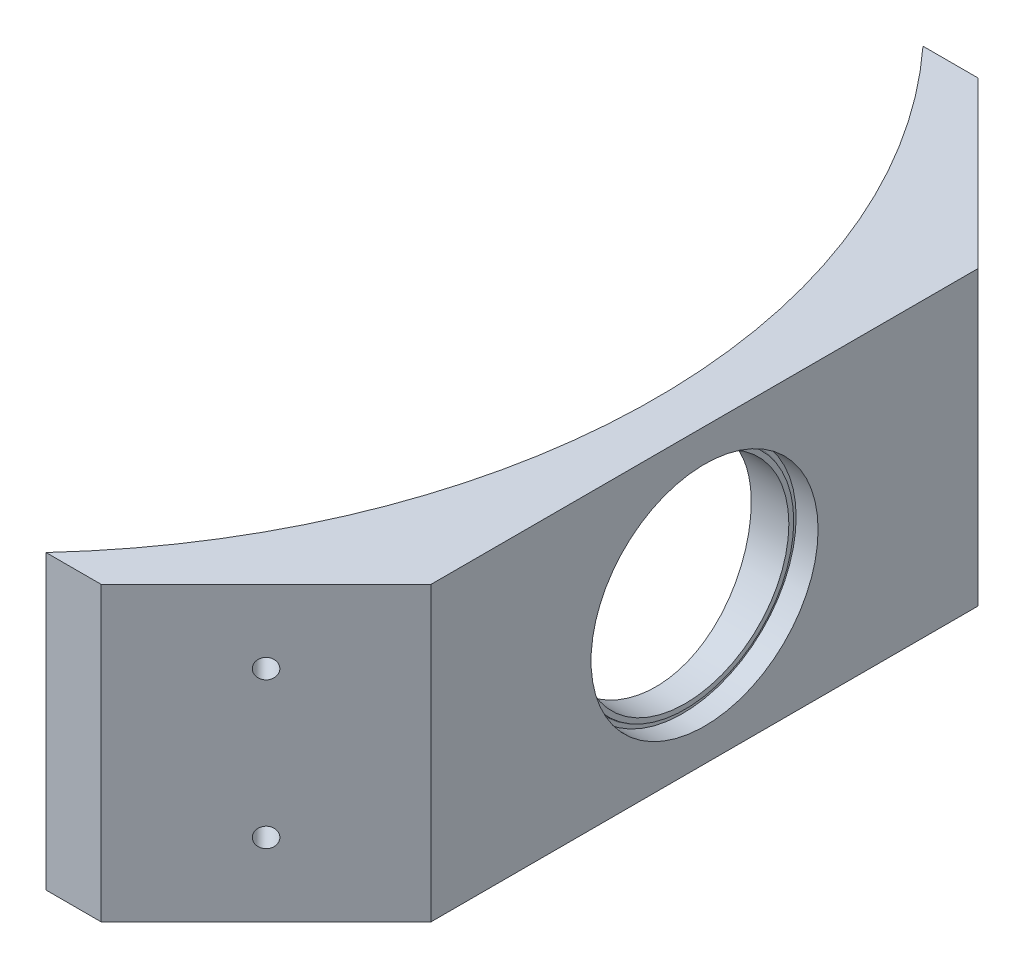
SolidWorks part; units mm, degrees
ref_plane "Front Plane" through (0, 0, 0) normal (0, 0, 1) x (1, 0, 0)
ref_plane "Top Plane" through (0, 0, 0) normal (0, 1, 0) x (1, 0, 0)
ref_plane "Right Plane" through (0, 0, 0) normal (1, 0, 0) x (0, 0, -1)
sketch "Sketch1" plane through (0, 0, 0) normal (1, 0, 0) x (0, 0, -1)
  line L0 (44.8181, 64.7501) -> (49.8181, 64.7501)
  line L1 (-35.1819, 64.7501) -> (-40.1819, 64.7501)
  line L2 (-40.1819, 64.7501) -> (-40.1819, 34.7501)
  line L3 (-35.1819, 64.7501) -> (44.8181, 64.7501)
  line L4 (-40.1819, 34.7501) -> (-35.1819, 34.7501)
  line L5 (4.8181, 49.7501) -> (4.8181, 64.7501) construction
  line L6 (49.8181, 64.7501) -> (49.8181, 34.7501)
  line L7 (44.8181, 34.7501) -> (-35.1819, 34.7501)
  line L8 (49.8181, 34.7501) -> (44.8181, 34.7501)
  circle A0 centre (4.8181, 49.7501) radius 10.65
  point P2 (4.8181, 34.7501)
  dimension "D1" = 5
  dimension "D2" = 5
extrude "Boss-Extrude1" add sketch "Sketch1" along normal blind 4
sketch "Sketch4" plane through (4, 0, 0) normal (1, 0, 0) x (0, 0, -1)
  circle A0 centre (4.8181, 49.7501) radius 10.65
  circle A3 centre (4.8181, 49.7501) radius 11.65
extrude "Cut-Extrude2" cut sketch "Sketch4" against normal blind 2
sketch "Sketch5" plane through (2, 0, 0) normal (1, 0, 0) x (0, 0, -1)
  circle A0 centre (4.8181, 49.7501) radius 11.65
  circle A1 centre (4.8181, 49.7501) radius 11.15
  dimension "D1" = 0.5
extrude "Cut-Extrude3" cut sketch "Sketch5" against normal blind 0.25
fillet "Fillet1" radius 0.1 1 edges at (1.75, 49.7501, -15.9681)
sketch "Sketch11" plane through (0, 64.7501, 0) normal (0, 1, 0) x (1, 0, 0)
  line L0 (0, 4.8181) -> (-1, 4.8181) construction
  line L2 (-1, 4.8181) -> (-67.37, 4.8181) construction
  line L3 (0, 49.8181) -> (0, -40.1819)
  line L4 (0, 49.8181) -> (0, -40.1819) construction
  line L5 (0, 49.8181) -> (-18.585, 49.8181)
  line L6 (0, -40.1819) -> (-18.585, -40.1819)
  arc A1 (-18.585, -40.1819) -> (-18.585, 49.8181) centre (-67.37, 4.8181) ccw
  dimension "D1" = 1
extrude "Boss-Extrude3" add sketch "Sketch11" against normal blind 30
sketch "Sketch12" plane through (0, 0, 0) normal (1, 0, 0) x (0, 0, -1)
  circle A0 centre (4.8181, 49.7501) radius 10.65
extrude "Cut-Extrude6" cut sketch "Sketch12" against normal blind 30
sketch "Sketch13" plane through (0, 64.7501, 0) normal (0, 1, 0) x (1, 0, 0)
  line L0 (-18.585, 49.8181) -> (-7.2925, 49.8181) construction
  line L2 (4, 49.8181) -> (4, -40.1819) construction
  line L3 (4, 4.8181) -> (-14.9281, 4.8181) construction
  line L4 (4, 49.8181) -> (-18.585, 49.8181) construction
  line L5 (-12.9387, 49.8181) -> (4, 32.8793)
  line L6 (4, 32.8793) -> (4, 49.8181)
  line L7 (4, 49.8181) -> (-12.9387, 49.8181)
  line L8 (-12.9387, -40.1819) -> (4, -23.2432)
  line L9 (4, -23.2432) -> (4, -40.1819)
  line L10 (4, -40.1819) -> (-12.9387, -40.1819)
extrude "Cut-Extrude7" cut sketch "Sketch13" against normal blind 30
sketch "Sketch14" plane through (-109.6206, 0, 136.8638) normal (-0.7071, 0, -0.7071) x (-0.7071, 0, 0.7071)
  line L0 (-148.7063, 64.7501) -> (-148.7063, 49.7501) construction
  line L1 (-160.6838, 64.7501) -> (-136.7288, 64.7501) construction
  line L3 (-136.7288, 49.7501) -> (-160.6838, 49.7501) construction
  line L4 (-136.7288, 34.7501) -> (-136.7288, 64.7501) construction
  line L5 (-160.6838, 34.7501) -> (-160.6838, 64.7501) construction
  circle A0 centre (-148.7063, 57.2501) radius 1
  circle A1 centre (-148.7063, 42.2501) radius 1
  dimension "D1" = 2
extrude "Cut-Extrude8" cut sketch "Sketch14" along normal blind 30
sketch "Sketch15" plane through (18.5398, 0, -18.3395) normal (-0.7071, 0, 0.7071) x (0.7071, 0, 0.7071)
  line L0 (-32.3983, 49.7501) -> (-32.3983, 64.7501) construction
  line L1 (-20.156, 49.7501) -> (-44.7869, 49.7501) construction
  line L2 (-20.5624, 64.7501) -> (-44.5174, 64.7501) construction
  circle A0 centre (-32.3983, 57.2501) radius 1
  circle A1 centre (-32.3983, 42.2501) radius 1
extrude "Cut-Extrude9" cut sketch "Sketch15" along normal blind 30
